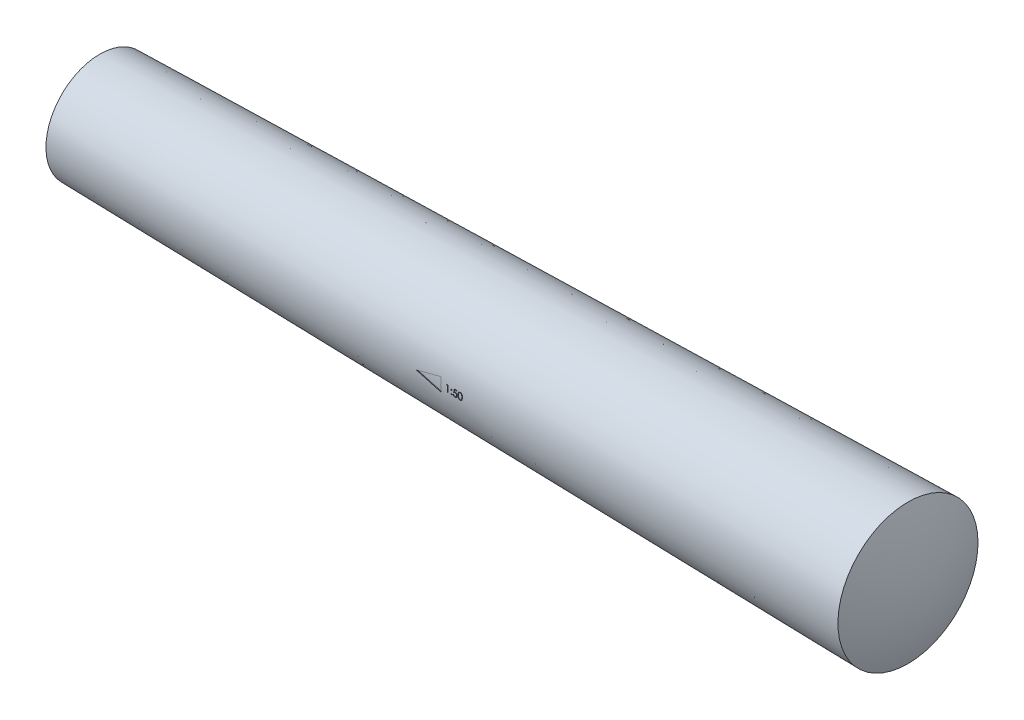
SolidWorks part; units mm, degrees
ref_plane "Front Plane" through (0, 0, 0) normal (0, 0, 1) x (1, 0, 0)
ref_plane "Top Plane" through (0, 0, 0) normal (0, 1, 0) x (1, 0, 0)
ref_plane "Right Plane" through (0, 0, 0) normal (1, 0, 0) x (0, 0, -1)
sketch "Sketch1" plane through (0, 0, 0) normal (1, 0, 0) x (0, 0, -1)
  circle A0 centre (0, 0) radius 8
  dimension "D1" = 16
extrude "Extrude1" add sketch "Sketch1" along normal mid plane 120
draft "Draft1" type of draft neutral plane draft angle 1.146 faces to draft 1 parameters "D1"=1.146
sketch "Sketch2" plane through (0, 0, 0) normal (0, 0, 1) x (1, 0, 0)
  line L0 (-60, 0) -> (-60, 8)
  line L1 (-60, 8) -> (-60, -8) construction
  line L2 (-60, 0) -> (-62, 0)
  line L3 (-62, 0) -> (-62, -9.2) construction
  line L4 (60, 0) -> (60, 10.4001)
  line L5 (60, -10.4001) -> (60, 10.4001) construction
  line L6 (60, 0) -> (62, 0)
  line L7 (62, 0) -> (62, -9.2) construction
  line L8 (-60, -8) -> (60, -10.4001) construction
  arc A0 (-62, 0) -> (-60, 8) centre (-45, 0) cw
  arc A1 (62, 0) -> (60, 10.4001) centre (33.9596, 0) ccw
  point P14 (0, -9.2)
revolve "Revolve1" add sketch "Sketch2" angle 360 about L2
sketch "Sketch5" plane through (0, 0, 0) normal (0, 0, 1) x (1, 0, 0)
  line L0 (0, 9.2) -> (0, -9.2) construction
  line L1 (60, 10.4001) -> (-60, 8) construction
  line L2 (-60, -8) -> (60, -10.4001) construction
ref_plane "Plane2" through (0, 0, 0) normal (-0.02, 0, 0.9998) x (0.9998, 0, 0.02)
sketch "Sketch6" plane through (0, 0, 0) normal (-0.02, 0, 0.9998) x (0.9998, 0, 0.02)
  line L0 (0, 0) -> (0, 1)
  line L1 (0, 9.2) -> (0, -9.2) construction
  line L2 (0, 1) -> (-3.7321, 0)
  line L3 (-3.7321, 0) -> (0, -1)
  line L4 (0, -1) -> (0, 0)
  line L5 (0, -0.5) -> (4, -0.5) construction
  text T0 "1:50" font "Century Gothic" height 1
  dimension "D1" = 2
  dimension "D2" = 30
  dimension "D3" = 4
wrap "Wrap2" sketch "Sketch6" wrap type deboss source sketch "Sketch6" thickness 0.1 parameters "D1"=0.1
equation "\"D2@Sketch2\" = \"D1@Sketch2\""
